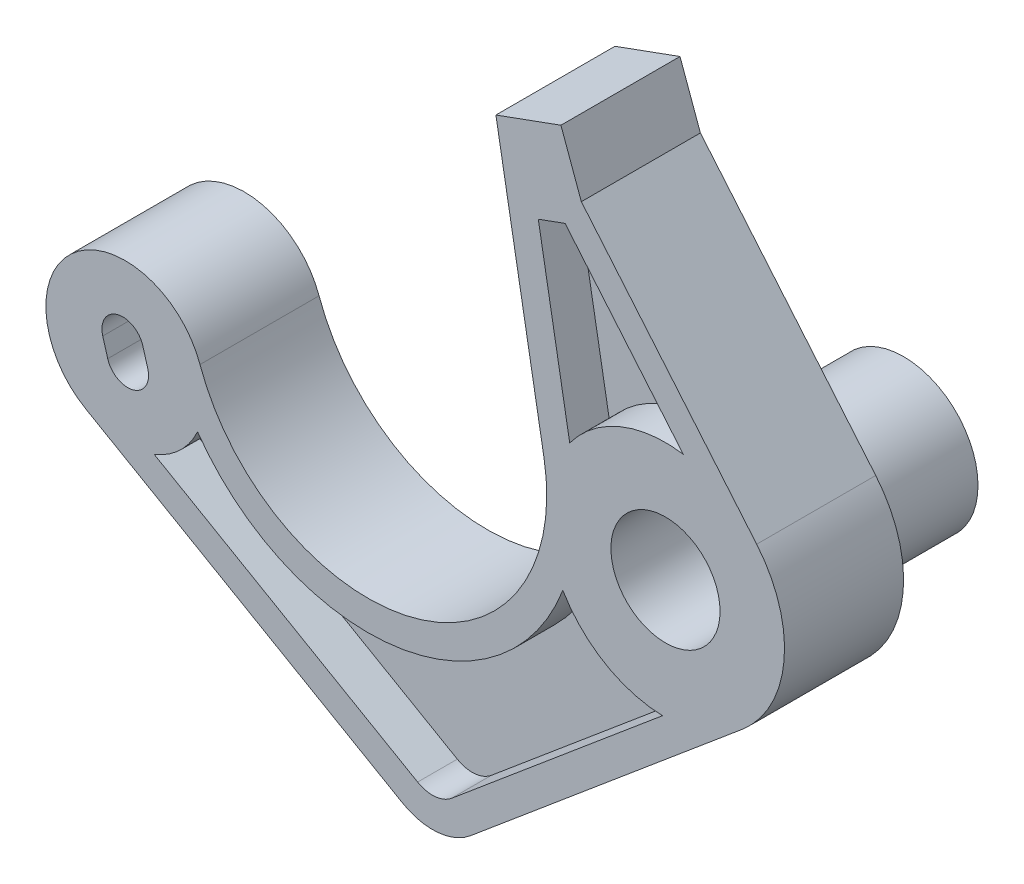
SolidWorks part; units mm, degrees
ref_plane "正面" through (0, 0, 0) normal (0, 0, 1) x (1, 0, 0)
ref_plane "平面" through (0, 0, 0) normal (0, 1, 0) x (1, 0, 0)
ref_plane "右側面" through (0, 0, 0) normal (1, 0, 0) x (0, 0, -1)
sketch "ｽｹｯﾁ1" plane through (0, 0, 0) normal (0, 0, 1) x (-1, 0, 0)
  line L5 (-28.1217, -9.6065) -> (-22.1656, -16.7048)
  line L6 (-22.1656, -16.7048) -> (-20.8163, -16.2137)
  line L7 (-20.8163, -16.2137) -> (-22.3989, -7.2381)
  line L8 (-1.4542, 3.7263) -> (-14.7342, 11.3935)
  line L9 (-16.4484, 11.2436) -> (-27.0779, 2.3243)
  line L22 (-22.9849, -18.0619) -> (-21.9572, -20.8856)
  line L23 (-21.9572, -20.8856) -> (-18.6797, -19.6927)
  line L24 (-18.6797, -19.6927) -> (-21.1052, -5.9373)
  line L25 (2, 3.4641) -> (-13.9842, 12.6926)
  line L26 (-17.4126, 12.3926) -> (-31.0822, 0.9224)
  line L27 (-31.8218, -7.5306) -> (-22.9849, -18.0619)
  arc A5 (-28.1217, -9.6065) -> (-22.3989, -7.2381) centre (-27.2255, -3.6738) ccw
  arc A6 (-22.0529, -0.6335) -> (-27.0779, 2.3243) centre (-27.2255, -3.6738) ccw
  arc A7 (-3.6432, 1.6515) -> (-22.0529, -0.6335) centre (-12.2419, -4.3745) ccw
  arc A8 (-1.4542, 3.7263) -> (-3.6432, 1.6515) centre (0, 0) ccw
  arc A9 (-14.7342, 11.3935) -> (-16.4484, 11.2436) centre (-15.4842, 10.0945) ccw
  arc A18 (-3.7667, -1.346) -> (-21.1052, -5.9373) centre (-12.2419, -4.3745) ccw
  arc A19 (-3.7667, -1.346) -> (2, 3.4641) centre (0, 0) ccw
  arc A20 (-13.9842, 12.6926) -> (-17.4126, 12.3926) centre (-15.4842, 10.0945) ccw
  arc A21 (-31.0822, 0.9224) -> (-31.8218, -7.5306) centre (-27.2255, -3.6738) ccw
extrude "ﾎﾞｽ - 押し出し1" add sketch "ｽｹｯﾁ1" along normal blind 6 contours A21 L27 L22 L23 L24 A18 A19 L25 A20 L26
sketch "ｽｹｯﾁ2" plane through (0, 0, 0) normal (0, 0, -1) x (-1, 0, 0)
  line L0 (-20.8163, 16.2137) -> (-22.3989, 7.2381) construction
  line L1 (-28.1217, 9.6065) -> (-22.1656, 16.7048) construction
  line L2 (-22.1656, 16.7048) -> (-20.8163, 16.2137) construction
  line L3 (-16.4484, -11.2436) -> (-27.0779, -2.3243) construction
  line L4 (-1.4542, -3.7263) -> (-14.7342, -11.3935) construction
  line L5 (-20.8163, 16.2137) -> (-22.3989, 7.2381)
  line L6 (-28.1217, 9.6065) -> (-22.1656, 16.7048)
  line L7 (-22.1656, 16.7048) -> (-20.8163, 16.2137)
  line L8 (-16.4484, -11.2436) -> (-27.0779, -2.3243)
  line L9 (-1.4542, -3.7263) -> (-14.7342, -11.3935)
  arc A0 (-22.3989, 7.2381) -> (-28.1217, 9.6065) centre (-27.2255, 3.6738) ccw construction
  arc A1 (-22.0529, 0.6335) -> (-3.6432, -1.6515) centre (-12.2419, 4.3745) ccw construction
  arc A2 (-27.0779, -2.3243) -> (-22.0529, 0.6335) centre (-27.2255, 3.6738) ccw construction
  arc A3 (-16.4484, -11.2436) -> (-14.7342, -11.3935) centre (-15.4842, -10.0945) ccw construction
  arc A4 (-3.6432, -1.6515) -> (-1.4542, -3.7263) centre (0, 0) ccw construction
  arc A5 (-22.3989, 7.2381) -> (-28.1217, 9.6065) centre (-27.2255, 3.6738) ccw
  arc A6 (-22.0529, 0.6335) -> (-3.6432, -1.6515) centre (-12.2419, 4.3745) ccw
  arc A7 (-27.0779, -2.3243) -> (-22.0529, 0.6335) centre (-27.2255, 3.6738) ccw
  arc A8 (-16.4484, -11.2436) -> (-14.7342, -11.3935) centre (-15.4842, -10.0945) ccw
  arc A9 (-3.6432, -1.6515) -> (-1.4542, -3.7263) centre (0, 0) ccw
extrude "ｶｯﾄ - 押し出し1" cut sketch "ｽｹｯﾁ2" against normal blind 2
sketch "ｽｹｯﾁ3" plane through (0, 0, 6) normal (0, 0, 1) x (1, 0, 0)
  line L0 (20.8163, 16.2137) -> (22.3989, 7.2381) construction
  line L1 (22.1656, 16.7048) -> (20.8163, 16.2137) construction
  line L2 (28.1217, 9.6065) -> (22.1656, 16.7048) construction
  line L3 (16.4484, -11.2436) -> (27.0779, -2.3243) construction
  line L4 (1.4542, -3.7263) -> (14.7342, -11.3935) construction
  line L5 (20.8163, 16.2137) -> (22.3989, 7.2381)
  line L6 (22.1656, 16.7048) -> (20.8163, 16.2137)
  line L7 (28.1217, 9.6065) -> (22.1656, 16.7048)
  line L8 (16.4484, -11.2436) -> (27.0779, -2.3243)
  line L9 (1.4542, -3.7263) -> (14.7342, -11.3935)
  arc A1 (28.1217, 9.6065) -> (22.3989, 7.2381) centre (27.2255, 3.6738) ccw construction
  arc A2 (22.0529, 0.6335) -> (27.0779, -2.3243) centre (27.2255, 3.6738) ccw construction
  arc A3 (3.6432, -1.6515) -> (22.0529, 0.6335) centre (12.2419, 4.3745) ccw construction
  arc A4 (1.4542, -3.7263) -> (3.6432, -1.6515) centre (0, 0) ccw construction
  arc A5 (14.7342, -11.3935) -> (16.4484, -11.2436) centre (15.4842, -10.0945) ccw construction
  arc A6 (28.1217, 9.6065) -> (22.3989, 7.2381) centre (27.2255, 3.6738) ccw
  arc A7 (22.0529, 0.6335) -> (27.0779, -2.3243) centre (27.2255, 3.6738) ccw
  arc A8 (3.6432, -1.6515) -> (22.0529, 0.6335) centre (12.2419, 4.3745) ccw
  arc A9 (1.4542, -3.7263) -> (3.6432, -1.6515) centre (0, 0) ccw
  arc A10 (14.7342, -11.3935) -> (16.4484, -11.2436) centre (15.4842, -10.0945) ccw
extrude "ｶｯﾄ - 押し出し2" cut sketch "ｽｹｯﾁ3" against normal blind 2
hole_wizard "Ø2.1 (2.1) 直径のｽﾛｯﾄ1" positions "ｽｹｯﾁ4" profile "ｽｹｯﾁ5" size "Ø2.1" standard "JIS"
sketch "ｽｹｯﾁ4" plane through (0, 0, 6) normal (0, 0, 1) x (1, 0, 0)
  line L0 (-0.4172, 1.4408) -> (0.4172, -1.4408) construction
  point P0 (0, 0)
  point P6 (-2.0186, 9.7941)
  point P7 (-2.7813, 9.6054)
  dimension "D1" = 3
sketch "ｽｹｯﾁ5" plane through (0, 0, 6) normal (1, 0, 0) x (0, -1, 0)
  line L0 (0, 0) -> (0, 12.1309)
  line L1 (0, 12.1309) -> (1.05, 11.5)
  line L2 (1.05, 11.5) -> (1.05, 0)
  line L5 (1.05, 0) -> (0, 0)
  line L10 (0, 12.1309) -> (-1.05, 11.5) construction
  line L11 (0, -6.35) -> (0, 107.95) construction
  dimension "穴の直径" = 2.1
  dimension "穴の深さ" = 11.5
  dimension "ﾄﾞﾘﾙ角度" = 118
sketch "ｽｹｯﾁ6" plane through (0, 0, 6) normal (0, 0, 1) x (1, 0, 0)
  circle A0 centre (27.2255, 3.6738) radius 2.75
  point P2 (27.2255, 3.6738)
  dimension "D1" = 5.5
extrude "ｶｯﾄ - 押し出し3" cut sketch "ｽｹｯﾁ6" against normal blind 14
sketch "ｽｹｯﾁ7" plane through (0, 0, 0) normal (0, 0, -1) x (-1, 0, 0)
  circle A0 centre (-27.2255, 3.6738) radius 3.75
  circle A1 centre (-27.2255, 3.6738) radius 2.75 construction
  circle A2 centre (-27.2255, 3.6738) radius 2.75
  dimension "D1" = 7.5
extrude "ﾎﾞｽ - 押し出し2" add sketch "ｽｹｯﾁ7" along normal blind 6
